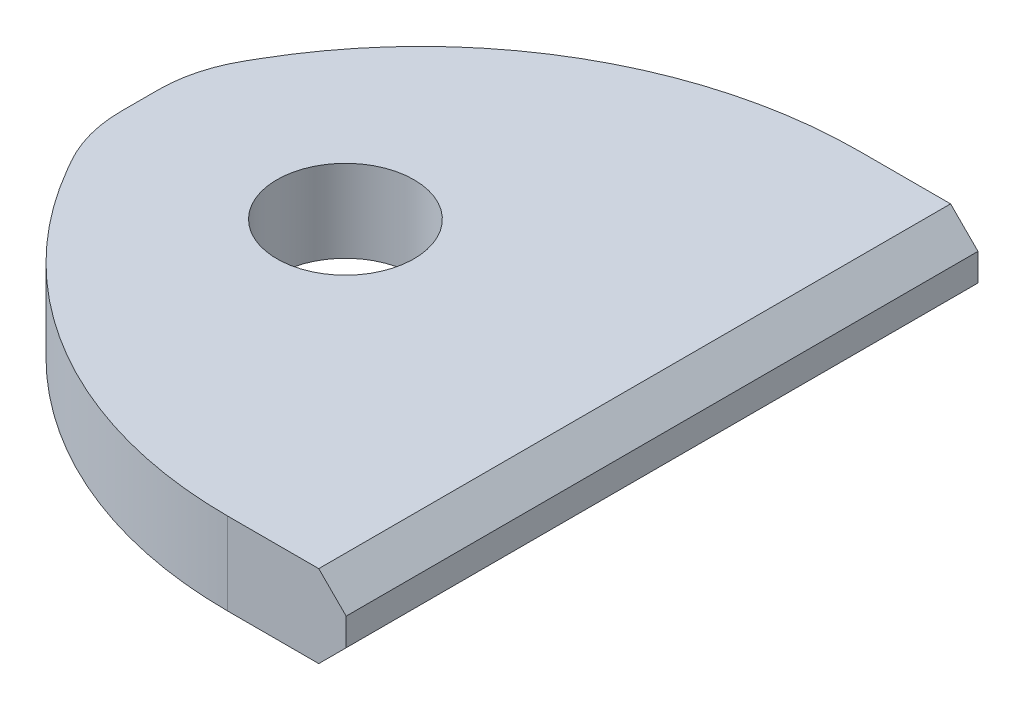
SolidWorks part; units mm, degrees
ref_plane "Front Plane" through (0, 0, 0) normal (0, 0, 1) x (1, 0, 0)
ref_plane "Top Plane" through (0, 0, 0) normal (0, 1, 0) x (1, 0, 0)
ref_plane "Right Plane" through (0, 0, 0) normal (1, 0, 0) x (0, 0, -1)
sketch "w665" plane through (0, 0, 0) normal (0, 1, 0) x (1, 0, 0)
  point P1 (35.941, 0)
  line B0 (-224.155, -274.828) -> (-224.155, -160.02)
  line B1 (-224.155, -160.02) -> (-51.181, -160.02)
  line B2 (-35.941, -144.78) -> (-35.941, 144.78)
  line B3 (-51.181, 160.02) -> (-224.155, 160.02)
  line B4 (-224.155, 160.02) -> (-224.155, 274.828)
  line B5 (-224.155, 274.828) -> (224.155, 274.828)
  line B6 (224.155, 274.828) -> (224.155, 160.02)
  line B7 (224.155, 160.02) -> (51.181, 160.02)
  line B8 (35.941, 144.78) -> (35.941, -144.78)
  line B9 (51.181, -160.02) -> (224.155, -160.02)
  line B10 (224.155, -160.02) -> (224.155, -274.828)
  line B11 (224.155, -274.828) -> (-224.155, -274.828)
  line B12 (0, -346.9641) -> (0, 274.828) construction
  arc B13 (-51.181, -160.02) -> (-35.941, -144.78) centre (-51.181, -144.78) ccw
  arc B14 (-35.941, 144.78) -> (-51.181, 160.02) centre (-51.181, 144.78) ccw
  arc B15 (51.181, 160.02) -> (35.941, 144.78) centre (51.181, 144.78) ccw
  arc B16 (35.941, -144.78) -> (51.181, -160.02) centre (51.181, -144.78) ccw
sketch_block_instance "W14x665-1"
sketch_block "W14x665" parameters "D6"=15.24, "D1"=71.882, "D2"=448.31, "D3"=549.656, "D4"=114.808, "D5"=114.808, "D7"=35.941
sketch "w193" plane through (0, 0, 0) normal (0, 1, 0) x (1, 0, 0)
  point P0 (11.303, 0)
  line B0 (-199.517, -196.596) -> (-199.517, -160.02)
  line B1 (-199.517, -160.02) -> (-26.543, -160.02)
  line B2 (-11.303, -144.78) -> (-11.303, 144.78)
  line B3 (-26.543, 160.02) -> (-199.517, 160.02)
  line B4 (-199.517, 160.02) -> (-199.517, 196.596)
  line B5 (-199.517, 196.596) -> (199.517, 196.596)
  line B6 (199.517, 196.596) -> (199.517, 160.02)
  line B7 (199.517, 160.02) -> (26.543, 160.02)
  line B8 (11.303, 144.78) -> (11.303, -144.78)
  line B9 (26.543, -160.02) -> (199.517, -160.02)
  line B10 (199.517, -160.02) -> (199.517, -196.596)
  line B11 (199.517, -196.596) -> (-199.517, -196.596)
  line B12 (0, -196.596) -> (0, 196.596) construction
  arc B13 (-26.543, -160.02) -> (-11.303, -144.78) centre (-26.543, -144.78) ccw
  arc B14 (-11.303, 144.78) -> (-26.543, 160.02) centre (-26.543, 144.78) ccw
  arc B15 (26.543, 160.02) -> (11.303, 144.78) centre (26.543, 144.78) ccw
  arc B16 (11.303, -144.78) -> (26.543, -160.02) centre (26.543, -144.78) ccw
sketch_block_instance "W14x193-1-1"
sketch_block "W14x193-1" parameters "D6"=15.24, "D1"=22.606, "D2"=399.034, "D3"=393.192, "D4"=36.576, "D5"=36.576, "D7"=11.303
sketch "C6" plane through (0, 0, 0) normal (0, 1, 0) x (1, 0, 0)
  line L3 (0, 87.6123) -> (0, 28.3016)
  line L4 (-7.1437, 87.6123) -> (7.1437, 87.6123)
  line L5 (-7.1437, 87.6123) -> (-7.1437, 42.6776)
  line L6 (-7.1437, 42.6776) -> (7.1437, 42.6776)
  line L7 (7.1437, 87.6123) -> (7.1437, 42.6776)
  line L8 (0, 28.3016) -> (36.6611, 28.3016)
  line L9 (34.0043, 76.2) -> (36.6611, 76.2)
  line L10 (34.0043, 76.2) -> (34.0043, -76.2)
  line L11 (34.0043, -76.2) -> (36.6611, -76.2)
  line L12 (36.6611, 76.2) -> (36.6611, -76.2)
  point P5 (-9.6837, 0)
  line B0 (-17.6593, -76.2) -> (-17.6593, 76.2)
  line B1 (-17.6593, 76.2) -> (34.0042, 76.2)
  line B2 (-17.6593, -76.2) -> (34.0043, -76.2)
  line B3 (6.7121, -67.4878) -> (-18.6879, -67.4878) construction
  line B4 (-9.6837, 57.3918) -> (-9.6837, -57.3918)
  line B5 (34.0042, 76.2) -> (34.0042, 73.7107)
  line B6 (34.0043, -76.2) -> (34.0043, -73.7107)
  line B7 (-3.3166, 64.9081) -> (31.4574, 70.7042)
  line B8 (-3.3166, -64.9081) -> (31.4574, -70.7042)
  arc B9 (-9.6837, -57.3918) -> (-3.3166, -64.9081) centre (-2.0637, -57.3918) ccw
  arc B10 (-9.6837, 57.3918) -> (-3.3166, 64.9081) centre (-2.0637, 57.3918) cw
  arc B11 (34.0042, 73.7107) -> (31.4574, 70.7042) centre (30.9562, 73.7107) cw
  arc B12 (34.0043, -73.7107) -> (31.4574, -70.7042) centre (30.9563, -73.7107) ccw
  dimension "D4" = 2.54
  dimension "D2" = 9.6837
  dimension "D1" = 14.2875
  dimension "D3" = 2.6568
sketch_block_instance "C6x10.5-1"
sketch_block "C6x10.5" parameters "D3"=7.62, "D6"=3.048, "D1"=152.4, "D2"=51.6636, "D4"=7.9756, "D5"=9.463, "D7"=2.4893, "D8"=8.7122, "D9"=12.6836
sketch "Sketch1" plane through (0, 0, 0) normal (0, 1, 0) x (1, 0, 0)
  line L5 (36.6611, 36.576) -> (36.6611, -36.576)
  line L6 (36.6611, 76.2) -> (36.6611, -76.2) construction
  line L8 (-23.8125, -2.1268) -> (-23.8125, 2.1268)
  line L9 (-21.6857, 10.0643) -> (-21.0438, 11.176)
  line L10 (22.9503, 36.576) -> (36.6611, 36.576)
  line L11 (0, -55) -> (0, 55) construction
  line L13 (36.6611, -36.576) -> (22.9503, -36.576)
  line L14 (-55, 0) -> (55, 0) construction
  line L15 (-21.6857, -10.0643) -> (-21.0438, -11.176)
  circle A4 centre (0, 0) radius 7.9375
  circle A5 centre (0, 0) radius 13.4874 construction
  circle A6 centre (0, 0) radius 23.8125 construction
  arc A8 (-23.8125, 2.1268) -> (-21.6857, 10.0643) centre (-7.9375, 2.1268) cw
  arc A10 (-23.8125, -2.1268) -> (-21.6857, -10.0643) centre (-7.9375, -2.1268) ccw
  arc A11 (22.9503, -36.576) -> (-21.0438, -11.176) centre (22.9503, 14.224) cw
  arc A12 (22.9503, 36.576) -> (-21.0438, 11.176) centre (22.9503, -14.224) ccw
  dimension "D1" = 15.875
  dimension "D4" = 15.875
  dimension "D2" = 26.9748
  dimension "D6" = 36.576
  dimension "D7" = 15.875
  dimension "D8" = 50.8
  dimension "D5" = 30
  dimension "D10" = 15.875
  dimension "D3" = 30
  dimension "D9" = 73.152
extrude "Boss-Extrude1" add sketch "Sketch1" along normal mid plane 9.525
chamfer "Chamfer1" distance 3.175 angle 45 2 edges at (36.6611, -4.7625, 0) (36.6611, 4.7625, 0)
